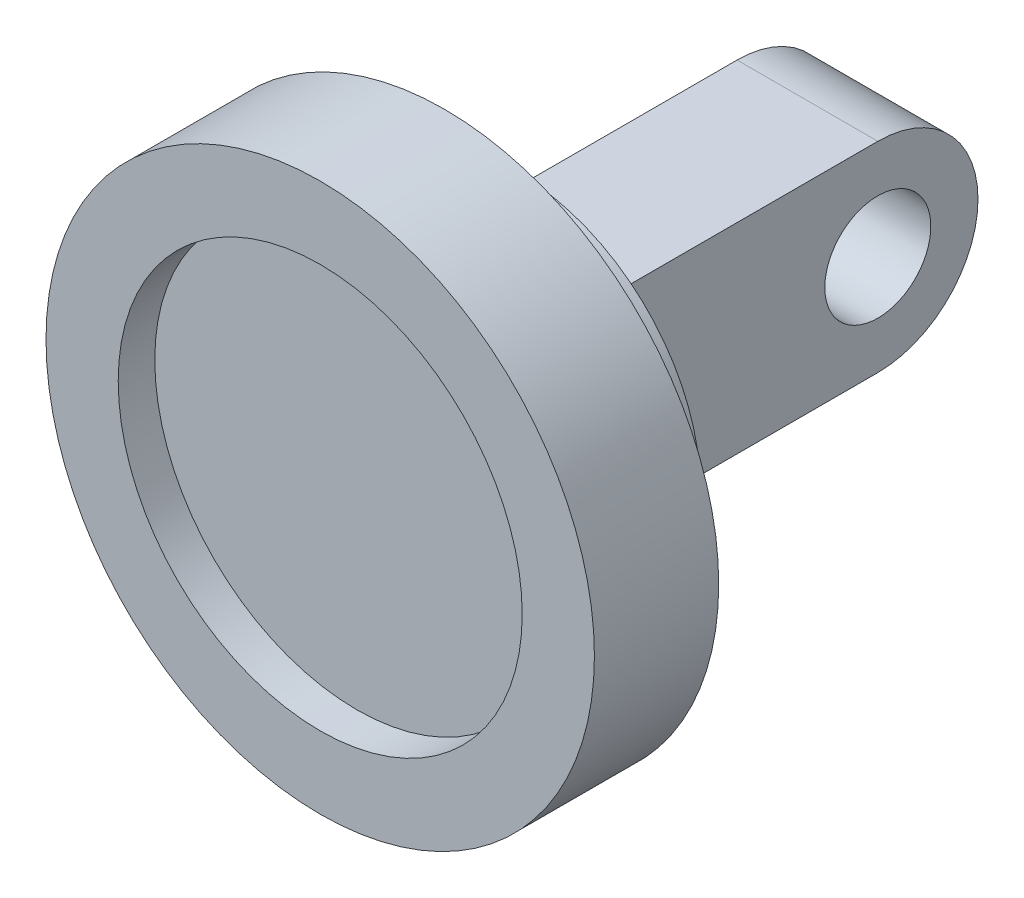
SolidWorks part; units mm, degrees
ref_plane "Alzado" through (0, 0, 0) normal (0, 0, 1) x (1, 0, 0)
ref_plane "Planta" through (0, 0, 0) normal (0, 1, 0) x (1, 0, 0)
ref_plane "Vista lateral" through (0, 0, 0) normal (1, 0, 0) x (0, 0, -1)
sketch "Croquis1" plane through (0, 0, 0) normal (1, 0, 0) x (0, 0, -1)
  line L0 (0, 0) -> (2819.9461, 0) construction
  line L1 (0, 110.5) -> (20, 110.5)
  line L2 (20, 110.5) -> (20, 0)
  line L3 (0, 110.5) -> (0, 150)
  line L4 (0, 150) -> (68, 150)
  line L5 (68, 150) -> (68, 100)
  line L6 (68, 100) -> (108, 100)
  line L7 (108, 100) -> (108, 0)
  line L8 (20, 0) -> (108, 0)
  dimension "D1" = 221
  dimension "D2" = 300
  dimension "D3" = 200
  dimension "D4" = 20
  dimension "D5" = 68
  dimension "D6" = 108
revolve "Revolución1" add sketch "Croquis1" angle 360 about L0
sketch "Croquis3" plane through (0, 0, -108) normal (0, 0, -1) x (-1, 0, 0)
  line L1 (-38.5, 92.2917) -> (38.5, 92.2917)
  line L2 (-38.5, 92.2917) -> (-38.5, -92.2917)
  line L3 (-38.5, -92.2917) -> (38.5, -92.2917)
  line L4 (38.5, 92.2917) -> (38.5, -92.2917)
  line L5 (-38.5, 92.2917) -> (38.5, -92.2917) construction
  line L6 (-38.5, -92.2917) -> (38.5, 92.2917) construction
  circle A0 centre (0, 0) radius 100 construction
  point P0 (0, 0)
  dimension "D1" = 77
extrude "Saliente-Extruir1" add sketch "Croquis3" along normal blind 213.3333
sketch "Croquis4" plane through (38.5, 0, 0) normal (1, 0, 0) x (0, 0, -1)
  line L0 (108, 54.8) -> (266.5333, 54.8)
  line L1 (108, -92.2917) -> (108, 92.2917) construction
  line L2 (266.5333, -54.8) -> (108, -54.8)
  line L3 (108, 92.2917) -> (108, -92.2917) construction
  line L4 (108, -54.8) -> (108, 54.8)
  line L5 (108, 0) -> (266.5333, 0) construction
  line L6 (321.3333, 92.2917) -> (321.3333, -92.2917) construction
  line L11 (108, 92.2917) -> (108, -92.2917)
  line L12 (108, -92.2917) -> (321.3333, -92.2917)
  line L13 (321.3333, -92.2917) -> (321.3333, 92.2917)
  line L14 (321.3333, 92.2917) -> (108, 92.2917)
  line L15 (108, 92.2917) -> (108, -92.2917)
  line L16 (108, -92.2917) -> (321.3333, -92.2917)
  line L17 (321.3333, -92.2917) -> (321.3333, 92.2917)
  line L18 (321.3333, 92.2917) -> (108, 92.2917)
  arc A0 (266.5333, 54.8) -> (266.5333, -54.8) centre (266.5333, 0) cw
  point P13 (321.3333, 0)
  dimension "D1" = 54.8
  dimension "D2" = 0
extrude "Cortar-Extruir1" cut sketch "Croquis4" against normal blind 800 contours L0 A0 L17 M13 M10 | A0 L2 M12 M10 M11
ref_plane "Plano1" through (0, 0, 0) normal (1, 0, 0) x (0, 0, -1)
sketch "Croquis5" plane through (0, 0, 0) normal (1, 0, 0) x (0, 0, -1)
  line L3 (108, -54.8) -> (266.5333, -54.8)
  line L4 (108, 54.8) -> (108, -54.8)
  line L5 (266.5333, 54.8) -> (108, 54.8)
  line L6 (108, -54.8) -> (266.5333, -54.8)
  line L7 (108, 54.8) -> (108, -54.8)
  line L8 (266.5333, 54.8) -> (108, 54.8)
  arc A1 (266.5333, -54.8) -> (266.5333, 54.8) centre (266.5333, 0) ccw
  arc A2 (266.5333, -54.8) -> (266.5333, 54.8) centre (266.5333, 0) ccw
  dimension "D1" = 0
extrude "Cortar-Extruir2" [suppressed] cut sketch "Croquis5" against normal mid plane 40
sketch "Croquis6" plane through (-38.5, 0, 0) normal (-1, 0, 0) x (0, 0, 1)
  circle A0 centre (-266.5333, 0) radius 29
  dimension "D1" = 58
extrude "Cortar-Extruir3" cut sketch "Croquis6" against normal through all
sketch "Croquis7" plane through (38.5, 0, 0) normal (1, 0, 0) x (0, 0, -1)
  line L0 (108, 54.8) -> (266.5333, 54.8) construction
  line L1 (209, 54.8) -> (187, 54.8)
  line L2 (209, 54.8) -> (209, -54.8)
  line L3 (209, -54.8) -> (187, -54.8)
  line L4 (187, 54.8) -> (187, -54.8)
  line L5 (209, 54.8) -> (187, -54.8) construction
  line L6 (209, -54.8) -> (187, 54.8) construction
  line L7 (266.5333, -54.8) -> (108, -54.8) construction
  line L8 (108, -100) -> (108, 100) construction
  point P0 (198, 0)
  dimension "D1" = 90
  dimension "D2" = 22
